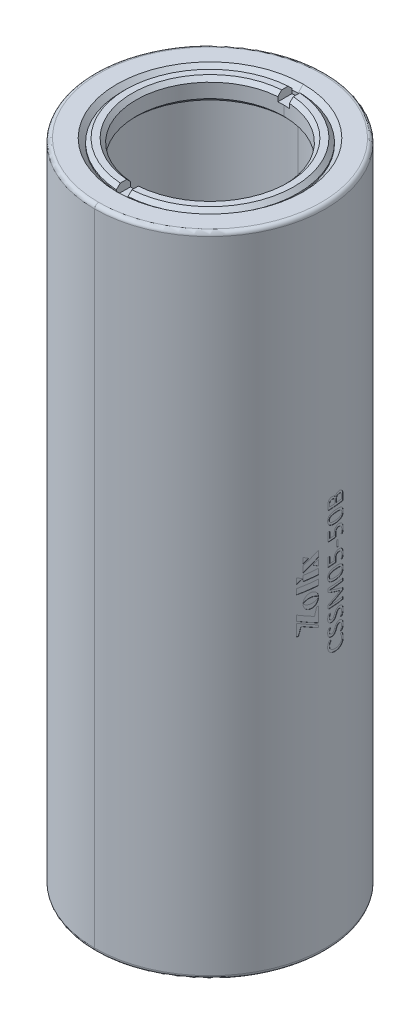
SolidWorks part; units mm, degrees
ref_plane "前视基准面" through (0, 0, 0) normal (0, 0, 1) x (1, 0, 0)
ref_plane "上视基准面" through (0, 0, 0) normal (0, 1, 0) x (1, 0, 0)
ref_plane "右视基准面" through (0, 0, 0) normal (1, 0, 0) x (0, 0, -1)
imported_body "SM05卡环.STEP-1-solid1"
imported_body "SM05卡环.STEP-2-solid1"
imported_body "CSSM05-50B-1.STEP-1-solid1"
sketch "草图1" plane through (0, 0, 0) normal (1, 0, 0) x (0, 0, -1)
  line L0 (8.9, 26.5082) -> (8.9, -22.8918) construction
  point P0 (-0.5, 1.8082)
  point P3 (8.9, 1.8082)
  line B0 (-0.5, 2.0208) -> (-0.5, 1.5957)
  line B1 (-0.5, 1.5957) -> (-1.9984, 1.5957)
  line B2 (-1.9984, 1.5957) -> (-1.9984, 2.0208)
  line B3 (-1.9984, 2.0208) -> (-0.5, 2.0208)
  line B4 (-1.5827, 2.887) -> (-1.5827, 3.3766)
  line B5 (-1.5827, 3.3766) -> (-0.5, 3.9712)
  line B6 (-0.5, 3.9712) -> (-0.5, 3.491)
  line B7 (-0.5, 3.491) -> (-1.5827, 2.887)
  line B8 (-1.5827, 3.4963) -> (-1.5827, 3.9402)
  line B9 (-1.5827, 3.9402) -> (-1.2035, 3.7183)
  line B10 (-1.2035, 3.7183) -> (-1.5827, 3.4963)
  line B11 (-0.9157, 3.1372) -> (-0.5, 2.8845)
  line B12 (-0.5, 2.8845) -> (-0.5, 3.3632)
  line B13 (-0.5, 3.3632) -> (-0.9157, 3.1372)
  line B14 (-1.0488, 0.615) -> (-1.1109, 0.6171)
  line B15 (-1.1109, 0.6171) -> (-1.1696, 0.6236)
  line B16 (-1.1696, 0.6236) -> (-1.2248, 0.6338)
  line B17 (-1.2248, 0.6338) -> (-1.2766, 0.647)
  line B18 (-1.2766, 0.647) -> (-1.3247, 0.6624)
  line B19 (-1.3247, 0.6624) -> (-1.369, 0.6798)
  line B20 (-1.369, 0.6798) -> (-1.4096, 0.6982)
  line B21 (-1.4096, 0.6982) -> (-1.4463, 0.7172)
  line B22 (-1.4463, 0.7172) -> (-1.4789, 0.7364)
  line B23 (-1.4789, 0.7364) -> (-1.5076, 0.7551)
  line B24 (-1.5076, 0.7551) -> (-1.532, 0.7724)
  line B25 (-1.532, 0.7724) -> (-1.5523, 0.7881)
  line B26 (-1.5523, 0.7881) -> (-1.5682, 0.8012)
  line B27 (-1.5682, 0.8012) -> (-1.5799, 0.8114)
  line B28 (-1.5799, 0.8114) -> (-1.5869, 0.8183)
  line B29 (-1.5869, 0.8183) -> (-1.5895, 0.8207)
  line B30 (-1.5895, 0.8207) -> (-1.5895, 0.8193)
  line B31 (-1.5895, 0.8193) -> (-1.5867, 0.7642)
  line B32 (-1.5867, 0.7642) -> (-1.5785, 0.7104)
  line B33 (-1.5785, 0.7104) -> (-1.5652, 0.6586)
  line B34 (-1.5652, 0.6586) -> (-1.547, 0.6088)
  line B35 (-1.547, 0.6088) -> (-1.5242, 0.5616)
  line B36 (-1.5242, 0.5616) -> (-1.4972, 0.517)
  line B37 (-1.4972, 0.517) -> (-1.466, 0.4755)
  line B38 (-1.466, 0.4755) -> (-1.4311, 0.4371)
  line B39 (-1.4311, 0.4371) -> (-1.3927, 0.4023)
  line B40 (-1.3927, 0.4023) -> (-1.3511, 0.3709)
  line B41 (-1.3511, 0.3709) -> (-1.3065, 0.3439)
  line B42 (-1.3065, 0.3439) -> (-1.2593, 0.3211)
  line B43 (-1.2593, 0.3211) -> (-1.2095, 0.3031)
  line B44 (-1.2095, 0.3031) -> (-1.1578, 0.2898)
  line B45 (-1.1578, 0.2898) -> (-1.1041, 0.2815)
  line B46 (-1.1041, 0.2815) -> (-1.0488, 0.2786)
  line B47 (-1.0488, 0.2786) -> (-0.9935, 0.2815)
  line B48 (-0.9935, 0.2815) -> (-0.9399, 0.2898)
  line B49 (-0.9399, 0.2898) -> (-0.888, 0.3031)
  line B50 (-0.888, 0.3031) -> (-0.8383, 0.3211)
  line B51 (-0.8383, 0.3211) -> (-0.7911, 0.3439)
  line B52 (-0.7911, 0.3439) -> (-0.7465, 0.3709)
  line B53 (-0.7465, 0.3709) -> (-0.7048, 0.4023)
  line B54 (-0.7048, 0.4023) -> (-0.6664, 0.4371)
  line B55 (-0.6664, 0.4371) -> (-0.6314, 0.4755)
  line B56 (-0.6314, 0.4755) -> (-0.6004, 0.517)
  line B57 (-0.6004, 0.517) -> (-0.5732, 0.5616)
  line B58 (-0.5732, 0.5616) -> (-0.5505, 0.6088)
  line B59 (-0.5505, 0.6088) -> (-0.5324, 0.6586)
  line B60 (-0.5324, 0.6586) -> (-0.5189, 0.7104)
  line B61 (-0.5189, 0.7104) -> (-0.5109, 0.7642)
  line B62 (-0.5109, 0.7642) -> (-0.5081, 0.8193)
  line B63 (-0.5081, 0.8193) -> (-0.5081, 0.8207)
  line B64 (-0.5081, 0.8207) -> (-0.5105, 0.8184)
  line B65 (-0.5105, 0.8184) -> (-0.5177, 0.8119)
  line B66 (-0.5177, 0.8119) -> (-0.5295, 0.8017)
  line B67 (-0.5295, 0.8017) -> (-0.5453, 0.7885)
  line B68 (-0.5453, 0.7885) -> (-0.5658, 0.773)
  line B69 (-0.5658, 0.773) -> (-0.5904, 0.7556)
  line B70 (-0.5904, 0.7556) -> (-0.619, 0.737)
  line B71 (-0.619, 0.737) -> (-0.6518, 0.7178)
  line B72 (-0.6518, 0.7178) -> (-0.6886, 0.6986)
  line B73 (-0.6886, 0.6986) -> (-0.7291, 0.6799)
  line B74 (-0.7291, 0.6799) -> (-0.7735, 0.6626)
  line B75 (-0.7735, 0.6626) -> (-0.8214, 0.647)
  line B76 (-0.8214, 0.647) -> (-0.8731, 0.634)
  line B77 (-0.8731, 0.634) -> (-0.9283, 0.6238)
  line B78 (-0.9283, 0.6238) -> (-0.9869, 0.6171)
  line B79 (-0.9869, 0.6171) -> (-1.0488, 0.615)
  line B80 (-1.5895, 0.8307) -> (-1.5869, 0.8331)
  line B81 (-1.5869, 0.8331) -> (-1.5799, 0.8398)
  line B82 (-1.5799, 0.8398) -> (-1.5682, 0.85)
  line B83 (-1.5682, 0.85) -> (-1.5523, 0.8632)
  line B84 (-1.5523, 0.8632) -> (-1.532, 0.8789)
  line B85 (-1.532, 0.8789) -> (-1.5076, 0.8963)
  line B86 (-1.5076, 0.8963) -> (-1.4789, 0.9147)
  line B87 (-1.4789, 0.9147) -> (-1.4463, 0.9339)
  line B88 (-1.4463, 0.9339) -> (-1.4096, 0.953)
  line B89 (-1.4096, 0.953) -> (-1.369, 0.9716)
  line B90 (-1.369, 0.9716) -> (-1.3247, 0.9888)
  line B91 (-1.3247, 0.9888) -> (-1.2766, 1.0043)
  line B92 (-1.2766, 1.0043) -> (-1.2248, 1.0174)
  line B93 (-1.2248, 1.0174) -> (-1.1696, 1.0274)
  line B94 (-1.1696, 1.0274) -> (-1.1109, 1.0339)
  line B95 (-1.1109, 1.0339) -> (-1.0488, 1.0364)
  line B96 (-1.0488, 1.0364) -> (-0.9869, 1.0339)
  line B97 (-0.9869, 1.0339) -> (-0.9283, 1.0274)
  line B98 (-0.9283, 1.0274) -> (-0.8731, 1.0174)
  line B99 (-0.8731, 1.0174) -> (-0.8214, 1.0041)
  line B100 (-0.8214, 1.0041) -> (-0.7735, 0.9886)
  line B101 (-0.7735, 0.9886) -> (-0.7291, 0.9712)
  line B102 (-0.7291, 0.9712) -> (-0.6886, 0.9528)
  line B103 (-0.6886, 0.9528) -> (-0.6518, 0.9335)
  line B104 (-0.6518, 0.9335) -> (-0.619, 0.9144)
  line B105 (-0.619, 0.9144) -> (-0.5904, 0.8958)
  line B106 (-0.5904, 0.8958) -> (-0.5658, 0.8784)
  line B107 (-0.5658, 0.8784) -> (-0.5453, 0.8627)
  line B108 (-0.5453, 0.8627) -> (-0.5295, 0.8496)
  line B109 (-0.5295, 0.8496) -> (-0.5177, 0.8395)
  line B110 (-0.5177, 0.8395) -> (-0.5105, 0.8329)
  line B111 (-0.5105, 0.8329) -> (-0.5081, 0.8307)
  line B112 (-0.5081, 0.8307) -> (-0.511, 0.8856)
  line B113 (-0.511, 0.8856) -> (-0.5195, 0.939)
  line B114 (-0.5195, 0.939) -> (-0.5329, 0.9905)
  line B115 (-0.5329, 0.9905) -> (-0.5512, 1.0398)
  line B116 (-0.5512, 1.0398) -> (-0.5739, 1.0868)
  line B117 (-0.5739, 1.0868) -> (-0.6011, 1.1311)
  line B118 (-0.6011, 1.1311) -> (-0.6321, 1.1724)
  line B119 (-0.6321, 1.1724) -> (-0.6669, 1.2105)
  line B120 (-0.6669, 1.2105) -> (-0.7053, 1.245)
  line B121 (-0.7053, 1.245) -> (-0.7467, 1.2758)
  line B122 (-0.7467, 1.2758) -> (-0.7913, 1.3027)
  line B123 (-0.7913, 1.3027) -> (-0.8384, 1.3252)
  line B124 (-0.8384, 1.3252) -> (-0.8881, 1.3431)
  line B125 (-0.8881, 1.3431) -> (-0.9399, 1.3564)
  line B126 (-0.9399, 1.3564) -> (-0.9935, 1.3647)
  line B127 (-0.9935, 1.3647) -> (-1.0488, 1.3673)
  line B128 (-1.0488, 1.3673) -> (-1.1038, 1.3647)
  line B129 (-1.1038, 1.3647) -> (-1.1572, 1.3564)
  line B130 (-1.1572, 1.3564) -> (-1.2089, 1.3431)
  line B131 (-1.2089, 1.3431) -> (-1.2584, 1.3252)
  line B132 (-1.2584, 1.3252) -> (-1.3054, 1.3027)
  line B133 (-1.3054, 1.3027) -> (-1.3498, 1.2758)
  line B134 (-1.3498, 1.2758) -> (-1.3912, 1.245)
  line B135 (-1.3912, 1.245) -> (-1.4296, 1.2105)
  line B136 (-1.4296, 1.2105) -> (-1.4645, 1.1724)
  line B137 (-1.4645, 1.1724) -> (-1.4955, 1.1311)
  line B138 (-1.4955, 1.1311) -> (-1.5227, 1.0868)
  line B139 (-1.5227, 1.0868) -> (-1.5457, 1.0398)
  line B140 (-1.5457, 1.0398) -> (-1.564, 0.9905)
  line B141 (-1.564, 0.9905) -> (-1.5777, 0.939)
  line B142 (-1.5777, 0.939) -> (-1.5862, 0.8856)
  line B143 (-1.5862, 0.8856) -> (-1.5895, 0.8307)
  line B144 (-1.9997, 0.245) -> (-1.9997, -0.176)
  line B145 (-1.9997, -0.176) -> (-0.5, -0.9146)
  line B146 (-0.5, -0.9146) -> (-0.5, 0.2276)
  line B147 (-0.5, 0.2276) -> (-0.6438, 0.2276)
  line B148 (-0.6438, 0.2276) -> (-0.7985, -0.3431)
  line B149 (-0.7985, -0.3431) -> (-1.9997, 0.245)
  line B150 (-1.9997, -0.3079) -> (-0.5, -1.0464)
  line B151 (-0.5, -1.0464) -> (-0.5, -1.2309)
  line B152 (-0.5, -1.2309) -> (-1.7078, -0.6321)
  line B153 (-1.7078, -0.6321) -> (-1.8827, -1.2145)
  line B154 (-1.8827, -1.2145) -> (-1.9997, -1.2145)
  line B155 (-1.9997, -1.2145) -> (-1.9997, -0.3079)
  line B156 (-0.5, 2.7377) -> (-0.5, 2.314)
  line B157 (-0.5, 2.314) -> (-1.5827, 2.314)
  line B158 (-1.5827, 2.314) -> (-1.5827, 2.7377)
  line B159 (-1.5827, 2.7377) -> (-0.5, 2.7377)
  line B160 (-1.9984, 2.3047) -> (-1.6096, 2.517)
  line B161 (-1.6096, 2.517) -> (-1.9984, 2.7391)
  line B162 (-1.9984, 2.7391) -> (-1.9984, 2.3047)
  dimension "D1" = 0.5
sketch_block_instance "1.5mmLogo字体-1"
sketch_block "1.5mmLogo字体" parameters "D1"=0.0031, "D2"=0.8502, "D3"=0.2341
wrap "包覆1" sketch "草图1" wrap type deboss source sketch "草图1" thickness 0.02 parameters "D1"=0.02
sketch "草图2" plane through (0, 0, 0) normal (1, 0, 0) x (0, 0, -1)
  line L0 (1.5014, -4.1918) -> (1.5014, 7.8082) construction
  line L1 (-0.4997, 1.5957) -> (-0.4997, 2.0208) construction
  line L2 (-0.4986, -0.9146) -> (-0.4986, 0.2276) construction
  text T0 "CSSM05-50B" font "Calibri" height 1.3
  point P2 (-0.4997, 1.8082)
  point P5 (1.5014, 1.8082)
  dimension "D1" = 12
  dimension "D2" = 2
wrap "包覆2" sketch "草图2" wrap type deboss source sketch "草图2" thickness 0.02 parameters "D1"=0.02
